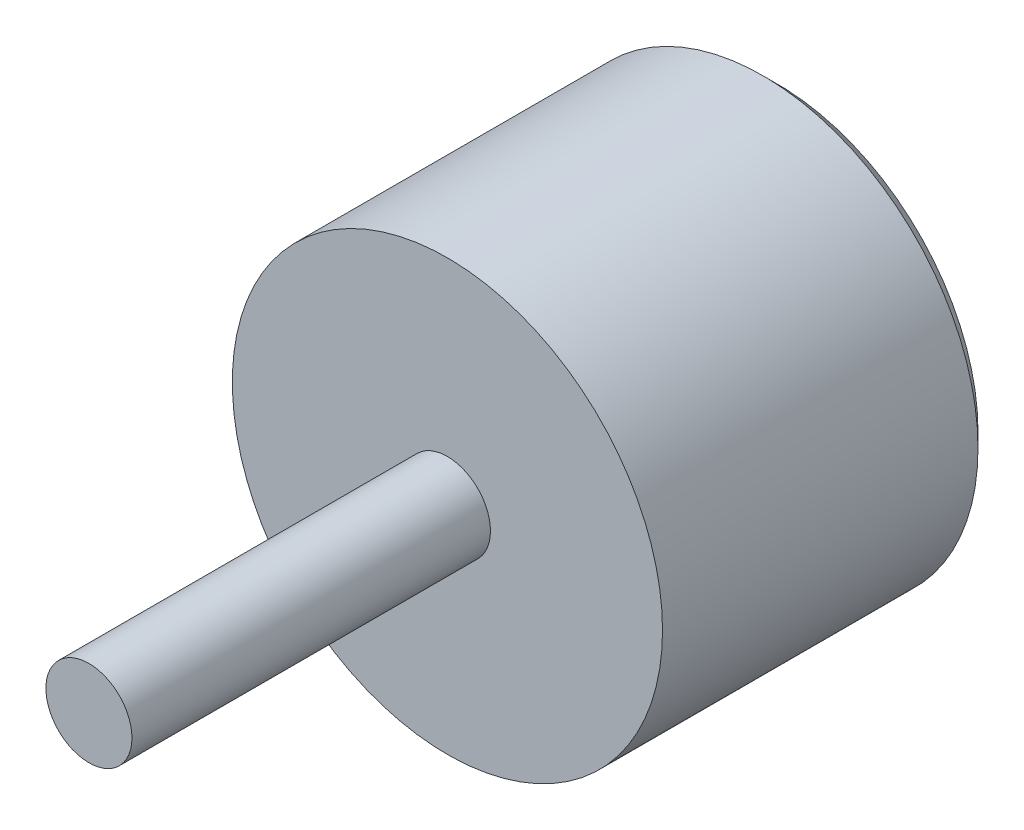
SolidWorks part; units mm, degrees
ref_plane "Plan de face" through (0, 0, 0) normal (0, 0, 1) x (1, 0, 0)
ref_plane "Plan de dessus" through (0, 0, 0) normal (0, 1, 0) x (1, 0, 0)
ref_plane "Plan de droite" through (0, 0, 0) normal (1, 0, 0) x (0, 0, -1)
sketch "Esquisse1" plane through (0, 0, 0) normal (0, 0, 1) x (1, 0, 0)
  circle A0 centre (0, 0) radius 30
  dimension "D1" = 60
extrude "Extrusion1" add sketch "Esquisse1" along normal blind 46
sketch "Esquisse2" plane through (0, 0, 46) normal (0, 0, 1) x (1, 0, 0)
  circle A0 centre (0, 0) radius 6
  dimension "D1" = 12
extrude "Extrusion2" add sketch "Esquisse2" along normal blind 50
sketch "Esquisse3" plane through (0, 0, 0) normal (0, 0, -1) x (-1, 0, 0)
  circle A0 centre (0, 0) radius 17.5
  dimension "D1" = 35
extrude "Enlèv. mat.-Extru.1" cut sketch "Esquisse3" against normal blind 30
chamfer "Chanfrein1" distance 2 angle 45 1 edges at (30, 0, 0)
